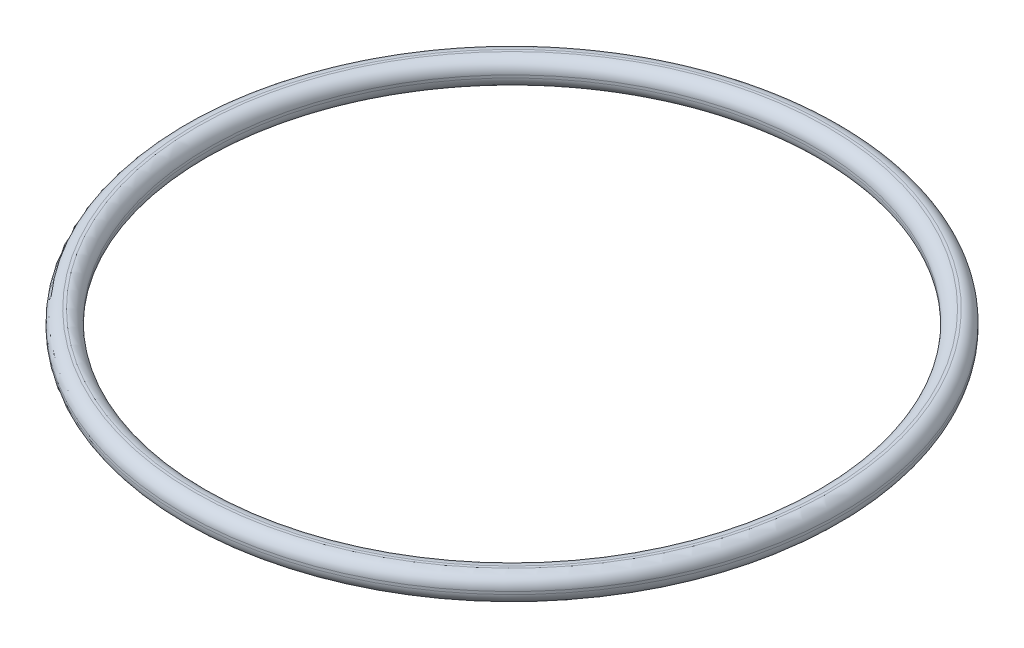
SolidWorks part; units mm, degrees
ref_plane "Front Plane" through (0, 0, 0) normal (0, 0, 1) x (1, 0, 0)
ref_plane "Top Plane" through (0, 0, 0) normal (0, 1, 0) x (1, 0, 0)
ref_plane "Right Plane" through (0, 0, 0) normal (1, 0, 0) x (0, 0, -1)
sketch "Sketch1" plane through (0, 0, 0) normal (0, 1, 0) x (1, 0, 0)
  circle A0 centre (0, 0) radius 11.5
  circle A1 centre (0, 0) radius 12.5
  dimension "D1" = 23
  dimension "D2" = 1
extrude "Boss-Extrude1" add sketch "Sketch1" along normal blind 1
fillet "Fillet1" radius 0.45 4 edges at (0, 0, 12.5) (0, 1, 12.5) (0, 1, 11.5) (0, 0, 11.5)
